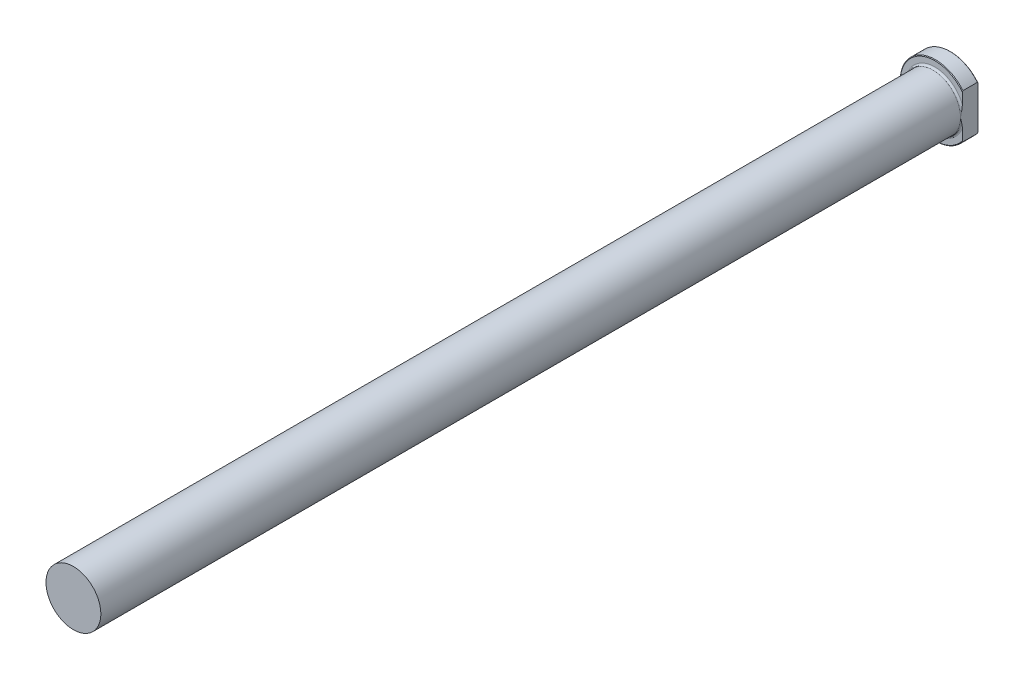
SolidWorks part; units mm, degrees
ref_plane "Front Plane" through (0, 0, 0) normal (0, 0, 1) x (1, 0, 0)
ref_plane "Top Plane" through (0, 0, 0) normal (0, 1, 0) x (1, 0, 0)
ref_plane "Right Plane" through (0, 0, 0) normal (1, 0, 0) x (0, 0, -1)
sketch "Sketch2" plane through (0, 0, 0) normal (1, 0, 0) x (0, 0, 1)
  line L0 (-2.1475, 0) -> (290.2977, 0) construction
  line L1 (355.6, 0) -> (0, 0)
  line L2 (0, 0) -> (0, 14.2875)
  line L3 (0, 14.2875) -> (6.35, 14.2875)
  line L4 (6.35, 11.8745) -> (6.35, 14.2875)
  line L7 (7.112, 11.1125) -> (355.6, 11.1125)
  line L8 (355.6, 0) -> (355.6, 11.1125)
  arc A0 (7.112, 11.1125) -> (6.35, 11.8745) centre (7.112, 11.8745) cw
revolve "Revolve1" add sketch "Sketch2" angle 360 about L0
sketch "Sketch4" plane through (0, 0, 0) normal (0, 0, 1) x (1, 0, 0)
  line L1 (11.1125, 8.9803) -> (11.1125, -8.9803)
  arc A3 (11.1125, -8.9803) -> (11.1125, 8.9803) centre (0, 0) ccw
extrude "Cut-Extrude2" cut sketch "Sketch4" along normal blind 7.62
chamfer "Chamfer1" distance 0.254 angle 45 2 edges at (-14.2875, 0, 6.35) (-14.2875, 0, 0)
equation "\"D1@Sketch4\"=0.5*\"D3@Sketch2\""
equation "\"D2@Sketch4\"=\"D1@Sketch2\""
